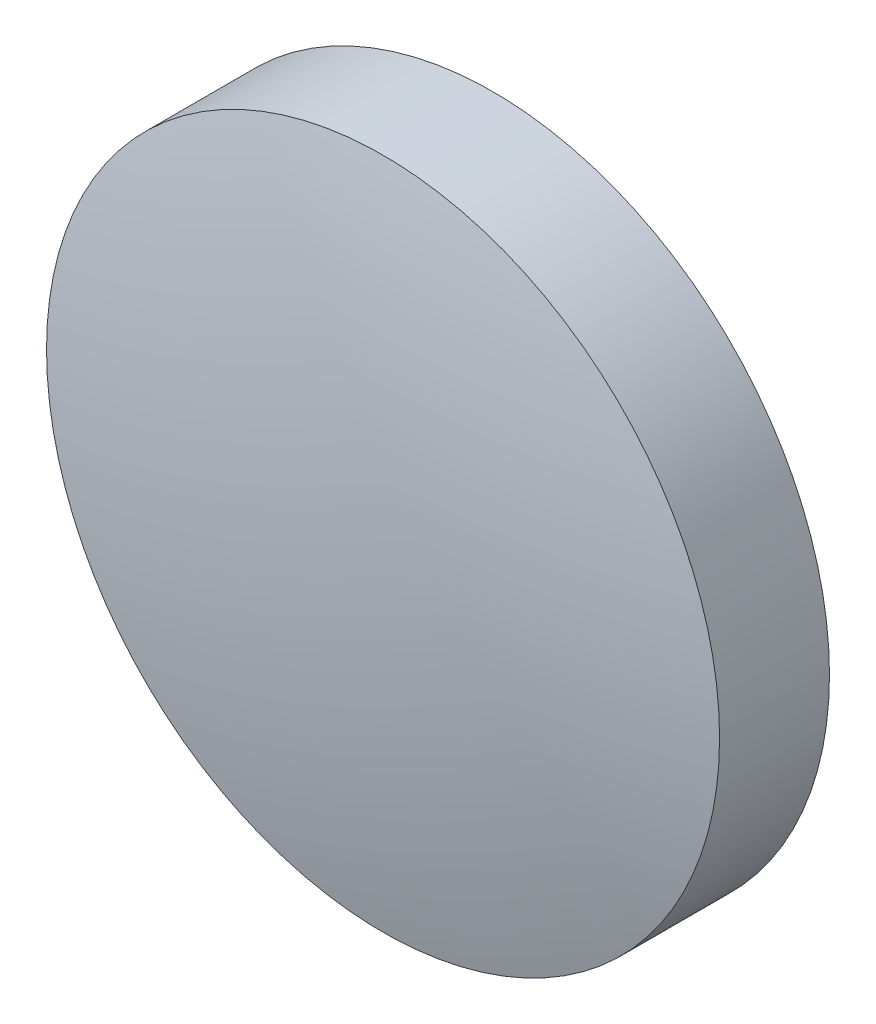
SolidWorks part; units mm, degrees
ref_plane "Front Plane" through (0, 0, 0) normal (0, 0, 1) x (1, 0, 0)
ref_plane "Top Plane" through (0, 0, 0) normal (0, 1, 0) x (1, 0, 0)
ref_plane "Right Plane" through (0, 0, 0) normal (1, 0, 0) x (0, 0, -1)
sketch "Sketch1" plane through (0, 0, 0) normal (0, 0, 1) x (1, 0, 0)
  circle A0 centre (0, 0) radius 17
  dimension "D1" = 34
extrude "Boss-Extrude1" add sketch "Sketch1" along normal blind 5.552
sketch "Sketch2" plane through (0, 0, 0) normal (0, 1, 0) x (1, 0, 0)
  line L0 (0, 0) -> (0, 2.4665)
  line L1 (17, 0) -> (-17, 0) construction
  line L2 (0, 0) -> (17, 0)
  arc A0 (17, 0) -> (-17, 0) centre (0, -57.3525) ccw construction
  arc A1 (0, 2.4665) -> (17, 0) centre (0, -57.3525) cw
  dimension "D1" = 59.819
revolve "Revolve1" add sketch "Sketch2" angle 360 about L0
sketch "Sketch3" plane through (0, 0, 0) normal (0, 1, 0) x (1, 0, 0)
  line L0 (17, -5.552) -> (0, -5.552)
  line L1 (-17, -5.552) -> (17, -5.552) construction
  line L2 (0, -5.552) -> (0, -7.5079)
  arc A0 (-17, -5.552) -> (17, -5.552) centre (0, 67.3481) ccw construction
  arc A1 (0, -7.5079) -> (17, -5.552) centre (0, 67.3481) ccw
  dimension "D1" = 74.856
revolve "Revolve2" add sketch "Sketch3" angle 360 about L2
ref_plane "Plane1" through (0, 0, -2.4665) normal (0, 0, -1) x (-1, 0, 0)
ref_plane "Plane2" through (0, 0, 7.5079) normal (0, 0, 1) x (1, 0, 0)
